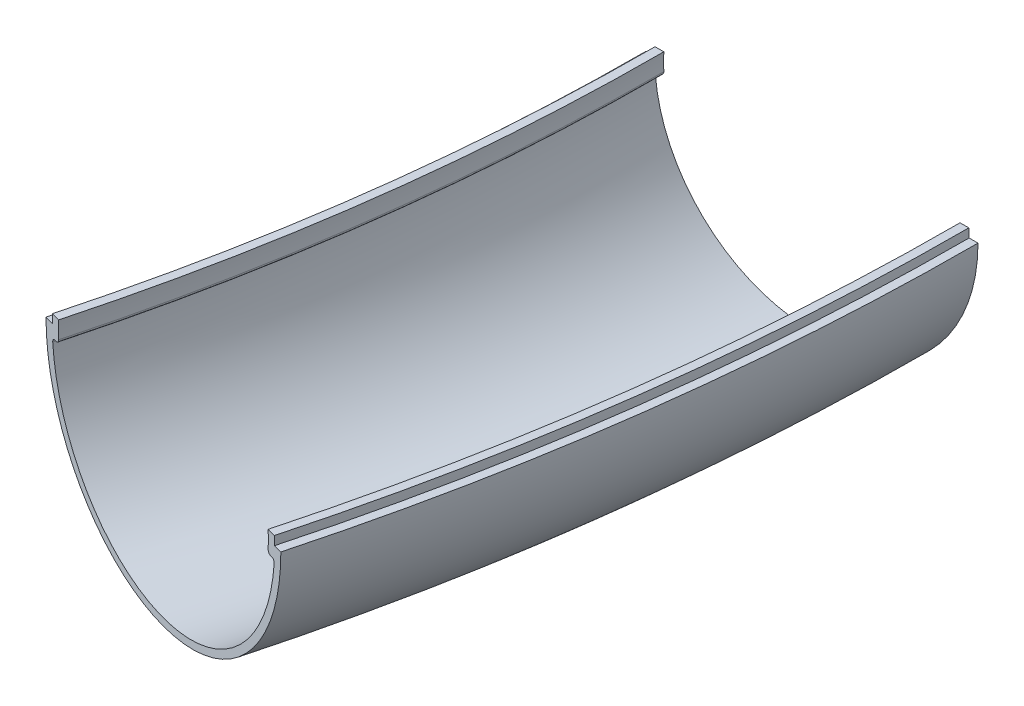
SolidWorks part; units mm, degrees
ref_plane "Спереди" through (0, 0, 0) normal (0, 0, 1) x (1, 0, 0)
ref_plane "Сверху" through (0, 0, 0) normal (0, 1, 0) x (1, 0, 0)
ref_plane "Справа" through (0, 0, 0) normal (1, 0, 0) x (0, 0, -1)
sketch "Эскиз1" plane through (0, 0, 0) normal (0, 0, 1) x (1, 0, 0)
  line L56 (185.8213, 0.7768) -> (186.6225, 0.7768)
  line L58 (185, 0) -> (185.8, 0)
  line L62 (214.2, 0) -> (215, 0)
  line L63 (213.3775, 0.7768) -> (214.1787, 0.7768)
  line L65 (0, 44.1102) -> (0, 0) construction
  line L89 (213.6769, -1.0953) -> (213.8449, -1.0953)
  line L90 (186.1551, -1.0953) -> (186.3231, -1.0953)
  arc A18 (185.8213, 0.7768) -> (185.8, 0) centre (200, 0) ccw
  arc A19 (214.2, 0) -> (214.1787, 0.7768) centre (200, 0) ccw
  arc A20 (185.8563, -1.4221) -> (214.1437, -1.4221) centre (200, -0.15) ccw
  arc A21 (213.3774, -0.7778) -> (213.3775, 0.7768) centre (200, 0) ccw
  arc A22 (214.2, 0) -> (214.1705, 0.7768) centre (200, -0.15) ccw
  arc A23 (185.8295, 0.7768) -> (185.8, 0) centre (200, -0.15) ccw
  arc A38 (186.6225, 0.7768) -> (186.6226, -0.7778) centre (200, 0) ccw
  arc A39 (185, 0) -> (215, 0) centre (200, 0) ccw
  arc A40 (213.8449, -1.0953) -> (214.1437, -1.4221) centre (213.8449, -1.3953) cw
  arc A41 (186.1551, -1.0953) -> (185.8563, -1.4221) centre (186.1551, -1.3953) ccw
  arc A42 (213.3774, -0.7778) -> (213.6769, -1.0953) centre (213.6769, -0.7953) ccw
  arc A43 (186.6226, -0.7778) -> (186.3231, -1.0953) centre (186.3231, -0.7953) cw
  point P39 (194.85, -0.55)
  point P58 (196.15, -7.55)
  point P60 (203.85, -7.55)
  point P61 (200, -0.15)
  dimension "D1" = 1.6
  dimension "D3" = 15
  dimension "D4" = 0.3
  dimension "D2" = 200
revolve "Повернуть1" add sketch "Эскиз1" angle 15 about L65
